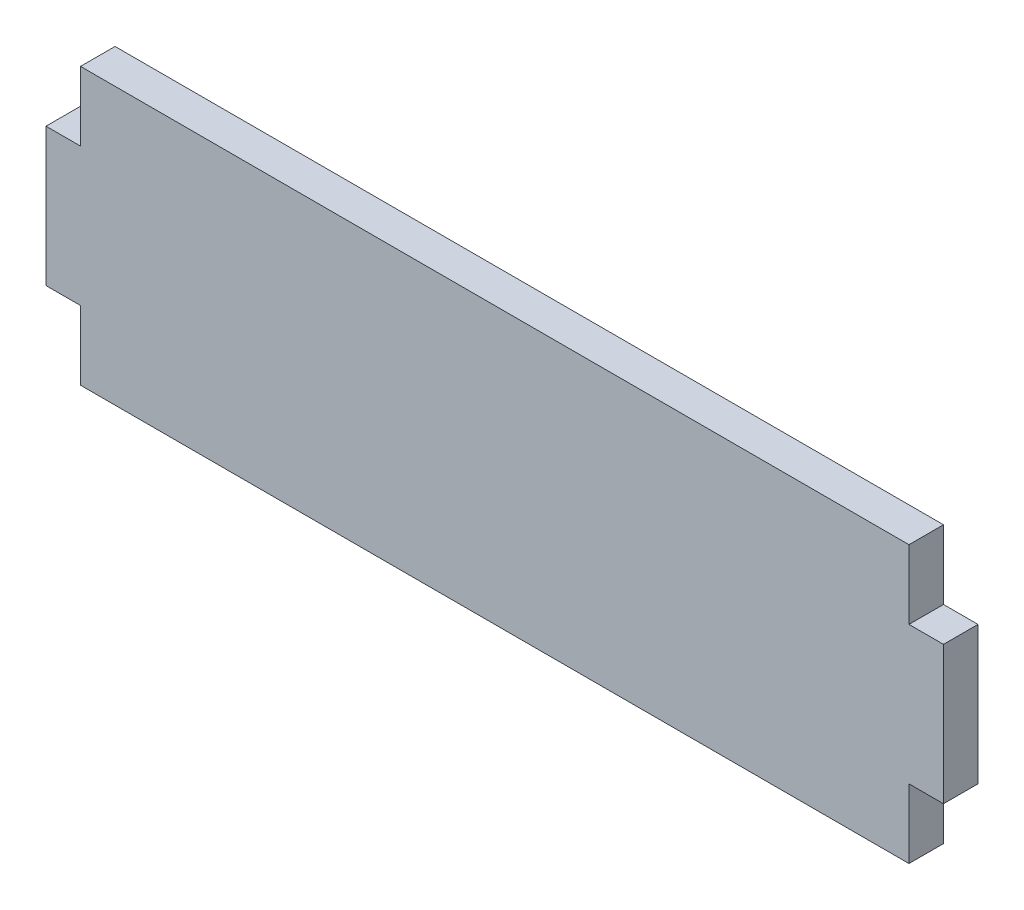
SolidWorks part; units mm, degrees
ref_plane "Front Plane" through (0, 0, 0) normal (0, 0, 1) x (1, 0, 0)
ref_plane "Top Plane" through (0, 0, 0) normal (0, 1, 0) x (1, 0, 0)
ref_plane "Right Plane" through (0, 0, 0) normal (1, 0, 0) x (0, 0, -1)
sketch "Sketch1" plane through (0, 0, 0) normal (0, 0, 1) x (1, 0, 0)
  line L0 (0, 12.7) -> (0, -12.7)
  line L1 (-41.275, -12.7) -> (41.275, -12.7)
  line L2 (-41.275, -12.7) -> (-41.275, 12.7)
  line L3 (-41.275, 12.7) -> (41.275, 12.7)
  line L4 (41.275, -12.7) -> (41.275, 12.7)
  line L5 (-41.275, -12.7) -> (41.275, 12.7) construction
  line L6 (-41.275, 12.7) -> (41.275, -12.7) construction
  line L7 (-41.275, 12.7) -> (-38.1, 12.7)
  line L8 (-41.275, 12.7) -> (-41.275, 6.35)
  line L9 (-41.275, 6.35) -> (-38.1, 6.35)
  line L10 (-38.1, 12.7) -> (-38.1, 6.35)
  line L11 (-41.275, 0) -> (41.275, 0)
  line L12 (41.275, 6.35) -> (38.1, 6.35)
  line L13 (38.1, 12.7) -> (38.1, 6.35)
  line L14 (41.275, -6.35) -> (38.1, -6.35)
  line L15 (38.1, -12.7) -> (38.1, -6.35)
  line L16 (-38.1, -12.7) -> (-38.1, -6.35)
  line L17 (-41.275, -6.35) -> (-38.1, -6.35)
  point P0 (0, 0)
  dimension "D1" = 82.55
  dimension "D2" = 25.4
  dimension "D3" = 6.35
  dimension "D4" = 3.175
extrude "Boss-Extrude1" add sketch "Sketch1" along normal blind 3.175 contours L2 L11 L0 L3 L10 L9 | L13 L3 L0 L11 L4 L12 | L1 L15 L14 L4 L11 L0 | L2 L17 L16 L1 L0 L11
